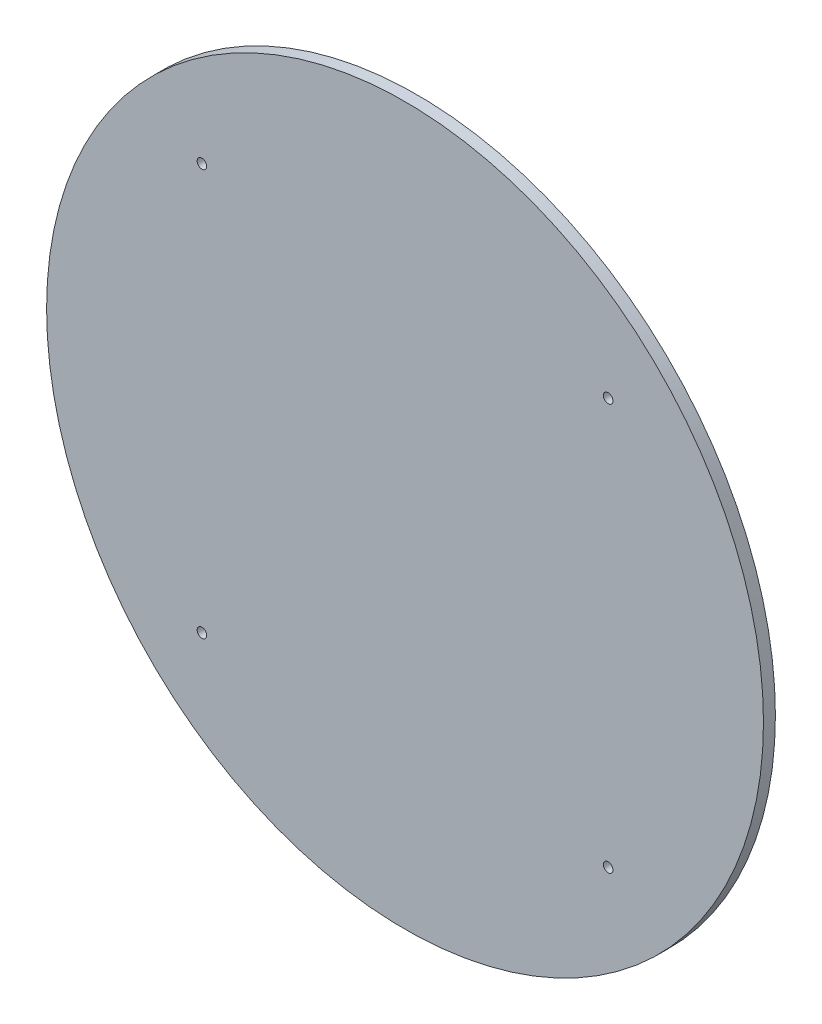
SolidWorks part; units mm, degrees
ref_plane "Front Plane" through (0, 0, 0) normal (0, 0, 1) x (1, 0, 0)
ref_plane "Top Plane" through (0, 0, 0) normal (0, 1, 0) x (1, 0, 0)
ref_plane "Right Plane" through (0, 0, 0) normal (1, 0, 0) x (0, 0, -1)
sketch "Sketch1" plane through (0, 0, 0) normal (0, 0, 1) x (1, 0, 0)
  circle A0 centre (0, 0) radius 150
  dimension "D1" = 300
extrude "Boss-Extrude1" add sketch "Sketch1" along normal blind 5
sketch "Sketch2" plane through (0, 0, 0) normal (0, 0, -1) x (-1, 0, 0)
  circle A0 centre (0, 0) radius 22.5
  circle A3 centre (0, 0) radius 27.5
  dimension "D2" = 5
  dimension "D1" = 45
extrude "Boss-Extrude2" add sketch "Sketch2" along normal blind 195
sketch "Sketch3" plane through (0, 0, 5) normal (0, 0, 1) x (1, 0, 0)
  line L1 (85, 85) -> (-85, 85)
  line L2 (85, 85) -> (85, -85)
  line L3 (85, -85) -> (-85, -85)
  line L4 (-85, 85) -> (-85, -85)
  line L5 (85, 85) -> (-85, -85) construction
  line L6 (85, -85) -> (-85, 85) construction
  point P0 (0, 0)
  dimension "D1" = 170
hole_wizard "Ø4.0 (4) Diameter Hole1" positions "Sketch4" profile "Sketch5" hole size "Ø4.0" standard "DIN"
sketch "Sketch4" plane through (0, 0, 5) normal (0, 0, 1) x (1, 0, 0)
  point P0 (-85, 85)
sketch "Sketch5" plane through (-85, 85, 5) normal (1, 0, 0) x (0, -1, 0)
  line L0 (0, 0) -> (0, 5)
  line L1 (0, 5) -> (2, 5)
  line L2 (2, 5) -> (2, 0)
  line L5 (2, 0) -> (0, 0)
  line L11 (0, -6.35) -> (0, 107.95) construction
  dimension "Thru Hole Dia." = 4
  dimension "Thru Hole Depth" = 5
pattern_curve "CrvPattern1" of "Ø4.0 (4) Diameter Hole1" parameters "D1"=2, "D3"=10, "D2"=2, "D4"=10
sketch "Sketch6" plane through (0, 0, -215.432) normal (0.9561, 0.2931, 0) x (-0.2931, 0.9561, 0)
  line L0 (27.5, 20.432) -> (27.5, 215.432) construction
  line L1 (-27.5, 215.432) -> (27.5, 215.432)
  line L2 (-27.5, 215.432) -> (-27.5, 20.432)
  line L3 (-27.5, 20.432) -> (27.5, 20.432)
  line L4 (27.5, 215.432) -> (27.5, 20.432)
  point P7 (27.5, 20.432)
extrude "Cut-Extrude1" cut sketch "Sketch6" against normal mid plane 100
